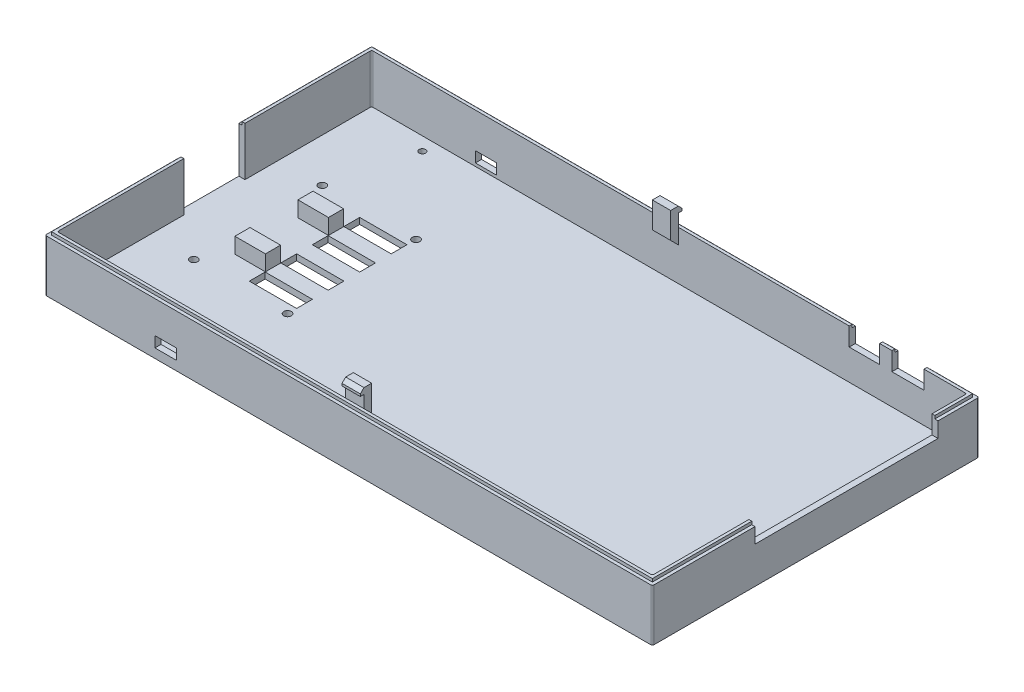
SolidWorks part; units mm, degrees
ref_plane "Front Plane" through (0, 0, 0) normal (0, 0, 1) x (1, 0, 0)
ref_plane "Top Plane" through (0, 0, 0) normal (0, 1, 0) x (1, 0, 0)
ref_plane "Right Plane" through (0, 0, 0) normal (1, 0, 0) x (0, 0, -1)
sketch "Sketch1" plane through (0, 0, 0) normal (0, 1, 0) x (1, 0, 0)
  line L1 (-97.5, 51.5) -> (97.5, 51.5)
  line L2 (-97.5, 51.5) -> (-97.5, -51.5)
  line L3 (-97.5, -51.5) -> (97.5, -51.5)
  line L4 (97.5, 51.5) -> (97.5, -51.5)
  line L5 (-97.5, 51.5) -> (97.5, -51.5) construction
  line L6 (-97.5, -51.5) -> (97.5, 51.5) construction
  point P0 (0, 0)
  dimension "D1" = 195
  dimension "D2" = 103
extrude "bottom plate" add sketch "Sketch1" along normal blind 2
sketch "Sketch2" plane through (0, 0, 0) normal (0, -1, 0) x (1, 0, 0)
  line L0 (99.5, 53.5) -> (-99.5, 53.5)
  line L1 (-99.5, 53.5) -> (-99.5, -53.5)
  line L2 (-99.5, -53.5) -> (99.5, -53.5)
  line L3 (99.5, -53.5) -> (99.5, 53.5)
  line L4 (97.5, -51.5) -> (97.5, 51.5)
  line L5 (97.5, 51.5) -> (-97.5, 51.5)
  line L6 (-97.5, 51.5) -> (-97.5, -51.5)
  line L7 (-97.5, -51.5) -> (97.5, -51.5)
  line L8 (97.5, -51.5) -> (97.5, 51.5)
  line L9 (97.5, 51.5) -> (-97.5, 51.5)
  line L10 (-97.5, 51.5) -> (-97.5, -51.5)
  line L11 (-97.5, -51.5) -> (97.5, -51.5)
  dimension "D1" = 0
  dimension "D2" = 2
extrude "side walls" add sketch "Sketch2" against normal blind 18 contours L1 L2 L3 L0 | L10 L11 L8 L9
sketch "Sketch3" plane through (99.5, 0, 0) normal (1, 0, 0) x (0, 0, -1)
  line L0 (51.12, 18) -> (51.12, 0) construction
  line L2 (-19.88, 18) -> (40.12, 18)
  line L3 (-19.88, 18) -> (-19.88, 12)
  line L4 (-53.5, 0) -> (53.5, 0)
  line L5 (53.5, 0) -> (53.5, 18)
  line L6 (53.5, 18) -> (-53.5, 18)
  line L7 (-53.5, 18) -> (-53.5, 0)
  line L8 (-53.5, 0) -> (53.5, 0)
  line L9 (53.5, 0) -> (53.5, 18)
  line L10 (53.5, 18) -> (-53.5, 18)
  line L11 (-53.5, 18) -> (-53.5, 0)
  line L12 (-19.88, 12) -> (40.12, 12)
  line L13 (40.12, 18) -> (40.12, 12)
  line L14 (-19.88, 18) -> (40.12, 12) construction
  line L15 (-19.88, 12) -> (40.12, 18) construction
  point P10 (10.12, 15)
  dimension "D2" = 2.38
  dimension "D3" = 71
  dimension "D4" = 60
  dimension "D5" = 6
  dimension "D1" = 0
extrude "connectors" cut sketch "Sketch3" against normal blind 12 contours L13 L3 L12 M7
sketch "Sketch4" plane through (0, 0, -53.5) normal (0, 0, -1) x (-1, 0, 0)
  line L0 (-92.5, 18) -> (-92.5, 0) construction
  line L2 (-83.5, 18) -> (-73, 18)
  line L3 (-83.5, 18) -> (-83.5, 12)
  line L4 (-99.5, 0) -> (99.5, 0)
  line L5 (99.5, 0) -> (99.5, 18)
  line L6 (99.5, 18) -> (-99.5, 18)
  line L7 (-99.5, 18) -> (-99.5, 0)
  line L8 (-99.5, 0) -> (99.5, 0)
  line L9 (99.5, 0) -> (99.5, 18)
  line L10 (99.5, 18) -> (-99.5, 18)
  line L11 (-99.5, 18) -> (-99.5, 0)
  line L12 (-83.5, 12) -> (-73, 12)
  line L13 (-73, 18) -> (-73, 12)
  line L14 (-83.5, 18) -> (-73, 12) construction
  line L15 (-83.5, 12) -> (-73, 18) construction
  line L16 (-69, 18) -> (-59, 18)
  line L17 (-69, 18) -> (-69, 12)
  line L18 (-69, 12) -> (-59, 12)
  line L19 (-59, 18) -> (-59, 12)
  line L20 (-69, 18) -> (-59, 12) construction
  line L21 (-69, 12) -> (-59, 18) construction
  point P10 (-78.25, 15)
  point P15 (-64, 15)
  dimension "D2" = 7
  dimension "D3" = 12
  dimension "D4" = 10.5
  dimension "D5" = 9
  dimension "D6" = 12
  dimension "D7" = 10
  dimension "D8" = 4
  dimension "D1" = 0
extrude "switches" cut sketch "Sketch4" against normal blind 12 contours L13 L3 L12 M13 | L19 L10 L17 L18
sketch "Sketch5" plane through (-99.5, 0, 0) normal (-1, 0, 0) x (0, 0, 1)
  line L0 (0, 0) -> (0, 18) construction
  line L2 (-10, 18) -> (10, 18)
  line L3 (-10, 18) -> (-10, 2)
  line L4 (-53.5, 0) -> (53.5, 0)
  line L5 (53.5, 0) -> (53.5, 18)
  line L6 (53.5, 18) -> (-53.5, 18)
  line L7 (-53.5, 18) -> (-53.5, 0)
  line L8 (-53.5, 0) -> (53.5, 0)
  line L9 (53.5, 0) -> (53.5, 18)
  line L10 (53.5, 18) -> (-53.5, 18)
  line L11 (-53.5, 18) -> (-53.5, 0)
  line L12 (-51.5, 2) -> (51.5, 2)
  line L13 (-51.5, 18) -> (-51.5, 2)
  line L14 (51.5, 18) -> (-51.5, 18)
  line L15 (51.5, 2) -> (51.5, 18)
  line L16 (-51.5, 2) -> (51.5, 2)
  line L17 (-51.5, 18) -> (-51.5, 2)
  line L18 (51.5, 18) -> (-51.5, 18)
  line L19 (51.5, 2) -> (51.5, 18)
  line L20 (-10, 2) -> (10, 2)
  line L21 (10, 18) -> (10, 2)
  point P10 (0, 12.5)
  dimension "D3" = 16
  dimension "D5" = 20
  dimension "D1" = 0
  dimension "D2" = 0
extrude "probes" cut sketch "Sketch5" against normal blind 12 contours L21 L3 L20 M15 | L16 L0 L18 L3
sketch "Sketch6" plane through (0, 0, 0) normal (0, -1, 0) x (1, 0, 0)
  line L1 (-68, 31.413) -> (-68, -32.3225) construction
  line L2 (-68, 18.085) -> (-52.5, 18.085)
  line L3 (-68, -2.575) -> (-52.5, -2.575)
  line L4 (99.5, -53.5) -> (99.5, 53.5)
  line L5 (99.5, 53.5) -> (-99.5, 53.5)
  line L6 (-99.5, 53.5) -> (-99.5, -53.5)
  line L7 (-99.5, -53.5) -> (99.5, -53.5)
  line L8 (99.5, -53.5) -> (99.5, 53.5)
  line L9 (99.5, 53.5) -> (-99.5, 53.5)
  line L10 (-99.5, 53.5) -> (-99.5, -53.5)
  line L11 (-99.5, -53.5) -> (99.5, -53.5)
  line L12 (97.5, -51.5) -> (97.5, 51.5)
  line L13 (-97.5, -51.5) -> (97.5, -51.5)
  line L14 (-97.5, -10) -> (-97.5, -51.5)
  line L15 (97.5, 51.5) -> (-97.5, 51.5)
  line L16 (97.5, -51.5) -> (97.5, 51.5)
  line L17 (-97.5, -51.5) -> (97.5, -51.5)
  line L18 (-97.5, -10) -> (-97.5, -51.5)
  line L19 (97.5, 51.5) -> (-97.5, 51.5)
  line L20 (-68, -2.575) -> (-68, -7.755)
  line L21 (-68, -7.755) -> (-52.5, -7.755)
  line L22 (-52.5, -2.575) -> (-52.5, -7.755)
  line L23 (-68, -2.575) -> (-52.5, -7.755) construction
  line L24 (-68, -7.755) -> (-52.5, -2.575) construction
  line L25 (-68, -12.905) -> (-52.5, -12.905)
  line L26 (-68, -12.905) -> (-68, -18.085)
  line L27 (-68, -18.085) -> (-52.5, -18.085)
  line L28 (-52.5, -12.905) -> (-52.5, -18.085)
  line L29 (-68, -12.905) -> (-52.5, -18.085) construction
  line L30 (-68, -18.085) -> (-52.5, -12.905) construction
  line L31 (-52.5, 12.905) -> (-52.5, 18.085)
  line L32 (-68, 12.905) -> (-52.5, 12.905)
  line L33 (-68, 12.905) -> (-68, 18.085)
  line L34 (-68, 7.755) -> (-52.5, 7.755)
  line L35 (-52.5, 2.575) -> (-52.5, 7.755)
  line L36 (-68, 2.575) -> (-52.5, 2.575)
  line L37 (-68, 2.575) -> (-68, 7.755)
  line L38 (-52.5, 21.05) -> (-52.5, -21.05) construction
  line L39 (-52.5, -21.05) -> (-83.22, -21.05) construction
  line L42 (99.5, 0) -> (-99.5, 0) construction
  line L48 (-97.5, 10) -> (-99.5, 10)
  line L49 (-97.5, 10) -> (-99.5, 10)
  line L50 (-97.5, 51.5) -> (-97.5, 10)
  line L51 (-97.5, 51.5) -> (-97.5, 10)
  line L52 (-99.5, -10) -> (-97.5, -10)
  line L54 (-99.5, 10) -> (-99.5, -10)
  line L55 (-99.5, 10) -> (-99.5, -10)
  line L56 (-99.5, -10) -> (-97.5, -10)
  circle A0 centre (-52.5, -21.05) radius 1.25
  circle A1 centre (-83.22, -21.05) radius 1.25
  circle A2 centre (-83.22, 21.05) radius 1.25
  circle A3 centre (-52.5, 21.05) radius 1.25
  point P17 (-60.25, -5.165)
  point P22 (-60.25, -15.495)
  dimension "D13" = 2.5
  dimension "D3" = 29.5
  dimension "D4" = 21.05
  dimension "D5" = 5.18
  dimension "D6" = 15.5
  dimension "D7" = 15.5
  dimension "D8" = 5.18
  dimension "D9" = 5.15
  dimension "D10" = 21.05
  dimension "D12" = 30.72
  dimension "D1" = 0
  dimension "D2" = 0
extrude "probe/screw holes" cut sketch "Sketch6" against normal blind 12 contours L33 L32 L31 L2 | L37 L36 L35 L34 | L22 L3 L20 L21 | L28 L25 L26 L27 | A2 | A1 | A0 | A3
sketch "Sketch7" plane through (0, 2, 0) normal (0, 1, 0) x (1, 0, 0)
  line L0 (-52.5, 18.085) -> (-68, 18.085) construction
  line L1 (-52.5, 12.905) -> (-68, 12.905) construction
  line L2 (-52.5, 7.755) -> (-68, 7.755) construction
  line L3 (-52.5, 2.575) -> (-68, 2.575) construction
  line L4 (97.5, -51.5) -> (97.5, 51.5)
  line L5 (97.5, 51.5) -> (-97.5, 51.5)
  line L6 (-97.5, 51.5) -> (-97.5, 10)
  line L7 (-97.5, -51.5) -> (97.5, -51.5)
  line L8 (97.5, -51.5) -> (97.5, 51.5)
  line L9 (97.5, 51.5) -> (-97.5, 51.5)
  line L10 (-97.5, 51.5) -> (-97.5, 10)
  line L11 (-97.5, -51.5) -> (97.5, -51.5)
  line L12 (-52.5, -2.575) -> (-68, -2.575) construction
  line L13 (-52.5, -7.755) -> (-68, -7.755) construction
  line L14 (-52.5, -12.905) -> (-68, -12.905) construction
  line L15 (-52.5, -18.085) -> (-68, -18.085) construction
  line L16 (-52.5, -18.085) -> (-68, -18.085)
  line L17 (-52.5, -12.905) -> (-68, -12.905)
  line L18 (-52.5, -7.755) -> (-68, -7.755)
  line L19 (-52.5, -2.575) -> (-68, -2.575)
  line L20 (-52.5, 2.575) -> (-68, 2.575)
  line L21 (-52.5, 7.755) -> (-68, 7.755)
  line L22 (-52.5, 12.905) -> (-68, 12.905)
  line L23 (-52.5, 18.085) -> (-68, 18.085)
  line L24 (-68, 12.905) -> (-97.5, 12.905) construction
  line L25 (-78, 17.5956) -> (-78, -16.1475) construction
  line L26 (-68, 7.755) -> (-97.5, 7.755) construction
  line L28 (-68, 2.575) -> (-97.5, 2.575) construction
  line L29 (-68, 12.805) -> (-78, 12.805)
  line L30 (-68, -2.575) -> (-97.5, -2.575) construction
  line L31 (-68, 12.805) -> (-68, 7.855)
  line L32 (-68, -7.755) -> (-97.5, -7.755) construction
  line L33 (-68, 7.855) -> (-78, 7.855)
  line L34 (-68, -12.905) -> (-97.5, -12.905) construction
  line L35 (-78, 12.805) -> (-78, 7.855)
  line L36 (-68, 12.805) -> (-78, 7.855) construction
  line L37 (-68, 7.855) -> (-78, 12.805) construction
  line L38 (-68, 2.475) -> (-78, 2.475)
  line L39 (-68, 2.475) -> (-68, -2.475)
  line L40 (-68, -2.475) -> (-78, -2.475)
  line L41 (-78, 2.475) -> (-78, -2.475)
  line L42 (-68, 2.475) -> (-78, -2.475) construction
  line L43 (-68, -2.475) -> (-78, 2.475) construction
  line L44 (-68, -7.855) -> (-78, -7.855)
  line L45 (-68, -7.855) -> (-68, -12.805)
  line L46 (-68, -12.805) -> (-78, -12.805)
  line L47 (-78, -7.855) -> (-78, -12.805)
  line L48 (-68, -7.855) -> (-78, -12.805) construction
  line L49 (-68, -12.805) -> (-78, -7.855) construction
  line L57 (-99.5, -10) -> (-97.5, -10)
  line L58 (-99.5, -10) -> (-97.5, -10)
  line L59 (-97.5, -10) -> (-97.5, -51.5)
  line L60 (-97.5, -10) -> (-97.5, -51.5)
  line L61 (-97.5, 10) -> (-99.5, 10)
  line L63 (-99.5, 10) -> (-99.5, -10)
  line L64 (-99.5, 10) -> (-99.5, -10)
  line L65 (-97.5, 10) -> (-99.5, 10)
  point P28 (-73, 10.33)
  point P33 (-73, 0)
  point P38 (-73, -10.33)
  dimension "D2" = 19.5
  dimension "D3" = 0.1
  dimension "D4" = 0.1
  dimension "D5" = 0.1
  dimension "D6" = 0.1
  dimension "D7" = 0.1
  dimension "D8" = 0.1
  dimension "D9" = 10
  dimension "D10" = 10
  dimension "D11" = 10
  dimension "D1" = 0
extrude "Boss-Extrude3" add sketch "Sketch7" along normal blind 5.1 contours L44 L47 L46 L45 | L29 L35 L33 L31 | L39 L38 L41 L40
sketch "Sketch8" plane through (0, 0, 53.5) normal (0, 0, 1) x (1, 0, 0)
  line L1 (-63.5, 3) -> (-56.5, 3)
  line L2 (-63.5, 3) -> (-63.5, 6.5)
  line L3 (-63.5, 6.5) -> (-56.5, 6.5)
  line L4 (-99.5, 0) -> (99.5, 0)
  line L5 (99.5, 0) -> (99.5, 18)
  line L8 (-99.5, 0) -> (99.5, 0)
  line L12 (-97.5, 2) -> (97.5, 2)
  line L13 (-97.5, 18) -> (-97.5, 2)
  line L16 (-97.5, 2) -> (97.5, 2)
  line L20 (-56.5, 3) -> (-56.5, 6.5)
  line L21 (-63.5, 3) -> (-56.5, 6.5) construction
  line L22 (-63.5, 6.5) -> (-56.5, 3) construction
  line L30 (99.5, 0) -> (99.5, 18)
  line L36 (-97.5, 18) -> (-97.5, 2)
  line L40 (99.5, 18) -> (-99.5, 18)
  line L42 (99.5, 18) -> (-99.5, 18)
  line L44 (-99.5, 18) -> (-99.5, 0)
  line L45 (-99.5, 18) -> (-99.5, 0)
  line L47 (97.5, 18) -> (-97.5, 18)
  line L49 (97.5, 18) -> (-97.5, 18)
  line L51 (97.5, 2) -> (97.5, 18)
  line L53 (97.5, 2) -> (97.5, 18)
  point P12 (-60, 4.75)
  dimension "D3" = 1
  dimension "D5" = 7
  dimension "D6" = 3.5
  dimension "D1" = 0
  dimension "D2" = 0
extrude "Cut-Extrude5" cut sketch "Sketch8" against normal through all both and the other way through all contours L1 L20 L3 L2
sketch "Sketch10" plane through (0, 0, 53.5) normal (0, 0, 1) x (1, 0, 0)
  line L1 (-99.5, 18) -> (-98.45, 18)
  line L2 (-99.5, 18) -> (-99.5, 17)
  line L3 (-99.5, 17) -> (-98.45, 17)
  line L4 (-99.5, 0) -> (99.5, 0)
  line L5 (99.5, 0) -> (99.5, 18)
  line L8 (-99.5, 0) -> (99.5, 0)
  line L12 (-98.45, 18) -> (-98.45, 17)
  line L13 (-99.5, 18) -> (-98.45, 17) construction
  line L14 (-99.5, 17) -> (-98.45, 18) construction
  line L22 (99.5, 0) -> (99.5, 18)
  line L25 (99.5, 18) -> (-99.5, 18)
  line L27 (99.5, 18) -> (-99.5, 18)
  line L28 (-99.5, 18) -> (-99.5, 0)
  line L29 (-99.5, 18) -> (-99.5, 0)
  point P7 (-98.975, 17.5)
  dimension "D2" = 1
  dimension "D3" = 1.05
  dimension "D1" = 0
extrude "Cut-Extrude6" cut sketch "Sketch10" against normal through all both contours L12 L3 M13 M14
sketch "Sketch12" plane through (-98.45, 0, 0) normal (-1, 0, 0) x (0, 0, 1)
  line L1 (-53.5, 18) -> (-52.45, 18)
  line L2 (-53.5, 18) -> (-53.5, 17)
  line L3 (-53.5, 17) -> (-52.45, 17)
  line L4 (-10, 17) -> (-10, 18)
  line L5 (-10, 18) -> (-53.5, 18)
  line L6 (-53.5, 18) -> (-53.5, 17)
  line L7 (-53.5, 17) -> (-10, 17)
  line L9 (-10, 18) -> (-53.5, 18)
  line L10 (-53.5, 18) -> (-53.5, 17)
  line L11 (-53.5, 17) -> (-10, 17)
  line L12 (-52.45, 18) -> (-52.45, 17)
  line L13 (-53.5, 18) -> (-52.45, 17) construction
  line L14 (-53.5, 17) -> (-52.45, 18) construction
  line L15 (53.5, 18) -> (52.45, 18)
  line L16 (53.5, 18) -> (53.5, 17)
  line L17 (53.5, 17) -> (52.45, 17)
  line L18 (10, 17) -> (53.5, 17)
  line L19 (53.5, 17) -> (53.5, 18)
  line L20 (53.5, 18) -> (10, 18)
  line L21 (10, 18) -> (10, 17)
  line L22 (10, 17) -> (53.5, 17)
  line L23 (53.5, 17) -> (53.5, 18)
  line L24 (53.5, 18) -> (10, 18)
  line L25 (10, 18) -> (10, 17)
  line L26 (52.45, 18) -> (52.45, 17)
  line L27 (53.5, 18) -> (52.45, 17) construction
  line L28 (53.5, 17) -> (52.45, 18) construction
  line L32 (-10, 17) -> (-10, 18)
  point P6 (-52.975, 17.5)
  point P13 (52.975, 17.5)
  dimension "D2" = 1.05
  dimension "D4" = 1.05
  dimension "D1" = 0
  dimension "D3" = 0
extrude "Cut-Extrude7" cut sketch "Sketch12" against normal through all both contours L15 L26 L17 L16 | L12 M12 M13 M14
sketch "Sketch13" plane through (0, 0, -52.45) normal (0, 0, -1) x (-1, 0, 0)
  line L1 (-99.5, 18) -> (-98.45, 18)
  line L2 (-99.5, 18) -> (-99.5, 17)
  line L3 (-99.5, 17) -> (-98.45, 17)
  line L4 (-83.5, 17) -> (-83.5, 18)
  line L5 (-83.5, 18) -> (-99.5, 18)
  line L6 (-99.5, 18) -> (-99.5, 17)
  line L7 (-99.5, 17) -> (-83.5, 17)
  line L8 (-83.5, 17) -> (-83.5, 18)
  line L9 (-83.5, 18) -> (-99.5, 18)
  line L10 (-99.5, 18) -> (-99.5, 17)
  line L11 (-99.5, 17) -> (-83.5, 17)
  line L12 (-98.45, 18) -> (-98.45, 17)
  line L13 (-99.5, 18) -> (-98.45, 17) construction
  line L14 (-99.5, 17) -> (-98.45, 18) construction
  point P6 (-98.975, 17.5)
  dimension "D2" = 1.05
  dimension "D1" = 0
extrude "Cut-Extrude8" cut sketch "Sketch13" against normal through all both contours L12 M7 M8 M9
sketch "Sketch16" plane through (0, 0, -51.5) normal (0, 0, 1) x (1, 0, 0)
  line L0 (0, 2) -> (0, 18) construction
  line L6 (-3, 13) -> (3, 13)
  line L7 (-3, 13) -> (-3, 24)
  line L8 (-3, 24) -> (3, 24)
  line L9 (3, 13) -> (3, 24)
  line L10 (-3, 13) -> (3, 24) construction
  line L11 (-3, 24) -> (3, 13) construction
  line L12 (73, 12) -> (73, 18)
  line L13 (73, 18) -> (69, 18)
  line L14 (69, 18) -> (69, 12)
  line L15 (69, 12) -> (59, 12)
  line L16 (59, 12) -> (59, 18)
  line L17 (59, 18) -> (-97.5, 18)
  line L18 (-97.5, 18) -> (-97.5, 2)
  line L19 (-97.5, 2) -> (97.5, 2)
  line L21 (97.5, 18) -> (83.5, 18)
  line L22 (83.5, 18) -> (83.5, 12)
  line L23 (83.5, 12) -> (73, 12)
  line L24 (73, 12) -> (73, 18)
  line L25 (73, 18) -> (69, 18)
  line L26 (69, 18) -> (69, 12)
  line L27 (69, 12) -> (59, 12)
  line L28 (59, 12) -> (59, 18)
  line L29 (59, 18) -> (-97.5, 18)
  line L31 (-97.5, 2) -> (97.5, 2)
  line L33 (97.5, 18) -> (83.5, 18)
  line L34 (83.5, 18) -> (83.5, 12)
  line L35 (83.5, 12) -> (73, 12)
  line L47 (-97.5, 18) -> (-97.5, 2)
  line L49 (97.5, 2) -> (97.5, 18)
  line L50 (97.5, 2) -> (97.5, 18)
  point P14 (0, 18.5)
  dimension "D2" = 5
  dimension "D3" = 6
  dimension "D4" = 6
  dimension "D1" = 0
extrude "Boss-Extrude4" add sketch "Sketch16" along normal blind 2.5 contours L9 L8 L7 M26 | L6 L9 L7 M26
chamfer "Chamfer1" distance 2.5 angle 45 1 edges at (0, 13, -49)
sketch "Sketch17" plane through (0, 0, -51.5) normal (0, 0, -1) x (-1, 0, 0)
  line L1 (-3, 24) -> (3, 24)
  line L2 (-3, 24) -> (-3, 22.05)
  line L3 (-3, 22.05) -> (3, 22.05)
  line L4 (-3, 24) -> (-3, 18)
  line L5 (-3, 18) -> (3, 18)
  line L6 (3, 18) -> (3, 24)
  line L7 (3, 24) -> (-3, 24)
  line L8 (-3, 24) -> (-3, 18)
  line L9 (-3, 18) -> (3, 18)
  line L10 (3, 18) -> (3, 24)
  line L11 (3, 24) -> (-3, 24)
  line L12 (3, 24) -> (3, 22.05)
  line L13 (-3, 24) -> (3, 22.05) construction
  line L14 (-3, 22.05) -> (3, 24) construction
  point P6 (0, 23.025)
  dimension "D2" = 1.95
  dimension "D1" = 0
extrude "Boss-Extrude5" add sketch "Sketch17" along normal blind 1.2 contours L3 M6 M8 M9
chamfer "Chamfer2" distance 1.2 angle 45 1 edges at (0, 24, -52.7)
sketch "Sketch18" plane through (0, 0, 51.5) normal (0, 0, -1) x (-1, 0, 0)
  line L0 (0, 2) -> (0, 18) construction
  line L2 (-3, 13) -> (3, 13)
  line L3 (-3, 13) -> (-3, 24)
  line L4 (-97.5, 2) -> (97.5, 2)
  line L5 (97.5, 2) -> (97.5, 18)
  line L7 (97.5, 2) -> (97.5, 18)
  line L8 (-97.5, 2) -> (97.5, 2)
  line L12 (-3, 24) -> (3, 24)
  line L13 (3, 13) -> (3, 24)
  line L14 (-3, 13) -> (3, 24) construction
  line L15 (-3, 24) -> (3, 13) construction
  line L20 (97.5, 18) -> (-97.5, 18)
  line L22 (97.5, 18) -> (-97.5, 18)
  line L23 (-97.5, 18) -> (-97.5, 2)
  line L24 (-97.5, 18) -> (-97.5, 2)
  point P10 (0, 18.5)
  dimension "D4" = 6
  dimension "D1" = 0
extrude "Boss-Extrude6" add sketch "Sketch18" along normal blind 2.5 contours L22 L13 L12 L3 | L2 L13 L22 L3
chamfer "Chamfer3" distance 2.5 angle 45 1 edges at (0, 13, 49)
sketch "Sketch19" plane through (0, 0, 51.5) normal (0, 0, 1) x (1, 0, 0)
  line L1 (-3, 24) -> (3, 24)
  line L2 (-3, 24) -> (-3, 22.05)
  line L3 (-3, 22.05) -> (3, 22.05)
  line L4 (-3, 24) -> (-3, 18)
  line L5 (-3, 18) -> (3, 18)
  line L6 (3, 18) -> (3, 24)
  line L7 (3, 24) -> (-3, 24)
  line L8 (-3, 24) -> (-3, 18)
  line L9 (-3, 18) -> (3, 18)
  line L10 (3, 18) -> (3, 24)
  line L11 (3, 24) -> (-3, 24)
  line L12 (3, 24) -> (3, 22.05)
  line L13 (-3, 24) -> (3, 22.05) construction
  line L14 (-3, 22.05) -> (3, 24) construction
  point P6 (0, 23.025)
  dimension "D2" = 1.95
  dimension "D1" = 0
extrude "Boss-Extrude7" add sketch "Sketch19" along normal blind 1.2 contours L3 M6 M8 M9
chamfer "Chamfer4" distance 1.2 angle 45 1 edges at (0, 24, 52.7)
sketch "Sketch20" plane through (0, 2, 0) normal (0, 1, 0) x (1, 0, 0)
  line L1 (-76.5, 47.12) -> (92.5, 47.12) construction
  line L2 (-76.5, 47.12) -> (-76.5, -47.12) construction
  line L3 (-76.5, -47.12) -> (92.5, -47.12) construction
  line L4 (97.5, -51.5) -> (97.5, 51.5)
  line L5 (97.5, 51.5) -> (-97.5, 51.5)
  line L6 (-97.5, 51.5) -> (-97.5, 10)
  line L7 (-97.5, -51.5) -> (97.5, -51.5)
  line L8 (97.5, -51.5) -> (97.5, 51.5)
  line L9 (97.5, 51.5) -> (-97.5, 51.5)
  line L11 (-97.5, -51.5) -> (97.5, -51.5)
  line L12 (92.5, 47.12) -> (92.5, -47.12) construction
  line L20 (-99.5, -10) -> (-97.5, -10)
  line L21 (-99.5, -10) -> (-97.5, -10)
  line L22 (-97.5, -10) -> (-97.5, -51.5)
  line L23 (-97.5, -10) -> (-97.5, -51.5)
  line L24 (-97.5, 10) -> (-99.5, 10)
  line L26 (-99.5, 10) -> (-99.5, -10)
  line L27 (-99.5, 10) -> (-99.5, -10)
  line L28 (-97.5, 10) -> (-99.5, 10)
  line L33 (-97.5, 51.5) -> (-97.5, 10)
  circle A0 centre (-76.5, 47.12) radius 1.05
  circle A3 centre (-76.5, -47.12) radius 1.05
  circle A4 centre (92.5, 47.12) radius 1.05
  circle A5 centre (92.5, -47.12) radius 1.05
  point P2 (0, 0)
  dimension "D4" = 169
  dimension "D2" = 5
  dimension "D1" = 0
extrude "Cut-Extrude9" cut sketch "Sketch20" against normal through all contours A5
fillet "Fillet1" radius 0.5 8 edges at (97.5, 10, -51.5) (97.5, 10, 51.5) (-97.5, 10, -51.5) (-97.5, 10, 51.5) (-99.5, 8.5, 53.5) (-99.5, 8.5, -53.5) (99.5, 8.5, -53.5) (99.5, 8.5, 53.5)
